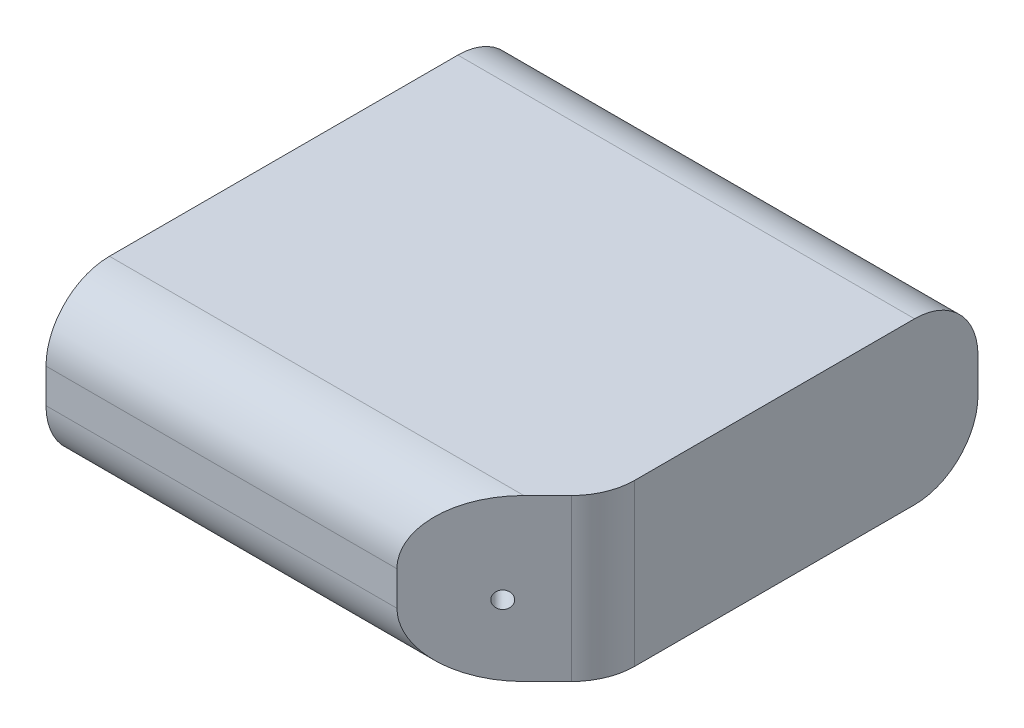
SolidWorks part; units mm, degrees
ref_plane "Front Plane" through (0, 0, 0) normal (0, 0, 1) x (1, 0, 0)
ref_plane "Top Plane" through (0, 0, 0) normal (0, 1, 0) x (1, 0, 0)
ref_plane "Right Plane" through (0, 0, 0) normal (1, 0, 0) x (0, 0, -1)
sketch "Sketch2" plane through (0, 0, 0) normal (1, 0, 0) x (0, 0, -1)
  line L1 (0, 0) -> (224.8, 0)
  line L2 (0, 0) -> (0, 76.2)
  line L3 (0, 76.2) -> (224.8, 76.2)
  line L4 (224.8, 0) -> (224.8, 76.2)
  dimension "D1" = 224.8
  dimension "D2" = 76.2
extrude "Extrude1" add sketch "Sketch2" against normal blind 216
chamfer "Chamfer1" distance 50 angle 45 1 edges at (0, 38.1, 0)
sketch "Sketch3" plane through (-85.3553, 0, 35.3553) normal (0.7071, 0, 0.7071) x (0.7071, 0, -0.7071)
  circle A1 centre (85.3553, 33.4988) radius 4
extrude "Cut-Extrude1" cut sketch "Sketch3" against normal blind 20
fillet "Fillet1" radius 30 5 edges at (-108, 0, -224.8) (-108, 76.2, -224.8) (-133, 0, 0) (-133, 76.2, 0) (0, 38.1, -50)
